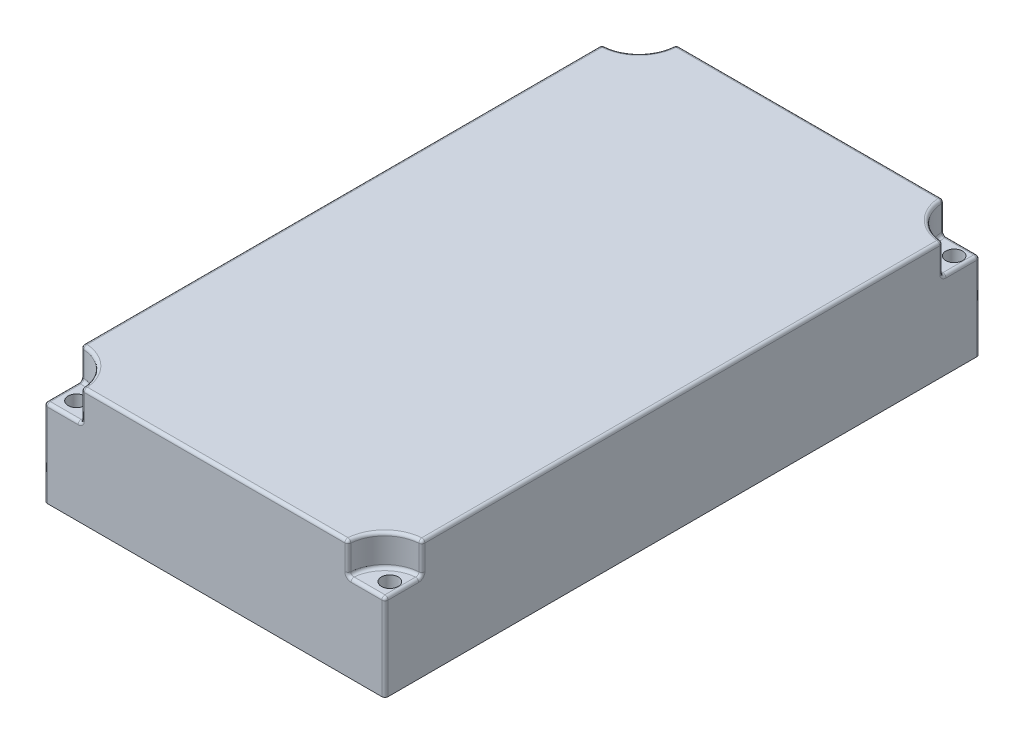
SolidWorks part; units mm, degrees
ref_plane "Plan de face" through (0, 0, 0) normal (0, 0, 1) x (1, 0, 0)
ref_plane "Plan de dessus" through (0, 0, 0) normal (0, 1, 0) x (1, 0, 0)
ref_plane "Plan de droite" through (0, 0, 0) normal (1, 0, 0) x (0, 0, -1)
sketch "Esquisse1" plane through (0, 0, 0) normal (0, 0, 1) x (1, 0, 0)
  line L1 (0, 0) -> (55, 0)
  line L2 (0, 0) -> (0, 19)
  line L3 (0, 19) -> (55, 19)
  line L4 (55, 0) -> (55, 19)
  dimension "D1" = 55
  dimension "D2" = 19
extrude "Extrusion1" add sketch "Esquisse1" along normal blind 96
sketch "Esquisse2" plane through (0, 0, 0) normal (0, -1, 0) x (1, 0, 0)
  line L0 (0, 96) -> (0, 0) construction
  line L1 (6.5, 93.5) -> (48.5, 93.5)
  line L2 (2.5, 89.5) -> (2.5, 6.5)
  line L3 (6.5, 2.5) -> (48.5, 2.5)
  line L4 (52.5, 89.5) -> (52.5, 6.5)
  line L5 (55, 96) -> (55, 0) construction
  line L6 (0, 96) -> (55, 96) construction
  line L7 (0, 0) -> (55, 0) construction
  arc A0 (2.5, 89.5) -> (6.5, 93.5) centre (2.5, 93.5) ccw
  arc A1 (48.5, 93.5) -> (52.5, 89.5) centre (52.5, 93.5) ccw
  arc A2 (6.5, 2.5) -> (2.5, 6.5) centre (2.5, 2.5) ccw
  arc A3 (52.5, 6.5) -> (48.5, 2.5) centre (52.5, 2.5) ccw
  dimension "D5" = 8
  dimension "D6" = 8
  dimension "D7" = 8
  dimension "D8" = 8
  dimension "D1" = 2.5
  dimension "D2" = 2.5
  dimension "D3" = 2.5
  dimension "D4" = 2.5
extrude "Enlèv. mat.-Extru.1" cut sketch "Esquisse2" against normal blind 17.5
fillet "Congé2" radius 0.5 24 edges at (52.5, 17.5, 48) (49.6716, 17.5, 5.3284) (27.5, 17.5, 2.5) (5.3284, 17.5, 5.3284) (2.5, 17.5, 48) (5.3284, 17.5, 90.6716) (27.5, 17.5, 93.5) (49.6716, 17.5, 90.6716) (55, 19, 48) (27.5, 19, 96) (0, 19, 48) (27.5, 19, 0) (55, 9.5, 0) (55, 9.5, 96) (0, 9.5, 96) (0, 9.5, 0) (48.5, 8.75, 93.5) (52.5, 8.75, 89.5) (2.5, 8.75, 6.5) (6.5, 8.75, 2.5) (48.5, 8.75, 2.5) (52.5, 8.75, 6.5) (6.5, 8.75, 93.5) (2.5, 8.75, 89.5)
sketch "Esquisse5" plane through (0, 19, 0) normal (0, 1, 0) x (1, 0, 0)
  circle A0 centre (0, 0) radius 6
  circle A1 centre (55.2211, 0) radius 6
  circle A2 centre (0, -96.0376) radius 6
  circle A4 centre (55, -96.0376) radius 6
  dimension "D1" = 12
  dimension "D2" = 12
  dimension "D3" = 12
  dimension "D4" = 12
extrude "Enlèv. mat.-Extru.2" cut sketch "Esquisse5" against normal blind 5
fillet "Congé3" radius 0.5 36 edges at (0.1464, 14, 95.8536) (54.8536, 14, 0.1464) (54.8536, 14, 95.8536) (0.1464, 14, 0.1464) (0, 14, 92.7688) (3.2499, 14, 96) (51.8606, 14, 0) (55, 14, 3.248) (51.7501, 14, 96) (55, 14, 92.7688) (0, 14, 3.25) (3.25, 14, 0) (0, 16.25, 90.0376) (0.8545, 18.1474, 90.0988) (4.2293, 19, 91.7816) (5.9982, 18.8123, 95.8905) (5.9999, 16.25, 96) (4.2293, 14, 91.7817) (50.901, 14, 4.1637) (55, 16.25, 5.9959) (54.8125, 18.8903, 5.9861) (50.9006, 19, 4.1633) (49.2221, 18.8123, 0.1096) (49.2211, 16.25, 0) (49.0001, 16.25, 96) (49.0667, 18.1474, 95.1455) (50.7707, 19, 91.7816) (54.9228, 18.7669, 90.0381) (55, 16.25, 90.0376) (50.7707, 14, 91.7817) (0, 16.25, 6) (4.2426, 14, 4.2426) (6, 16.25, 0) (5.9971, 18.8908, 0.1881) (4.2426, 19, 4.2426) (0.1096, 18.8123, 5.999)
hole_wizard "Dégagement M2.51" positions "Esquisse7" profile "Esquisse6" hole size "M2.5" standard "ISO"
sketch "Esquisse7" plane through (0, 14, 0) normal (0, 1, 0) x (-1, 0, 0)
  point P0 (-53.0631, 93.2839)
  point P1 (-53.0631, 2.1996)
  point P3 (-2.4965, 2.1996)
  point P5 (-2.4965, 93.2839)
sketch "Esquisse6" plane through (53.0631, 14, 93.2839) normal (1, 0, 0) x (0, 0, 1)
  line L0 (0, 0) -> (0, 14)
  line L1 (0, 14) -> (1.35, 14)
  line L2 (1.35, 14) -> (1.35, 0)
  line L5 (1.35, 0) -> (0, 0)
  line L11 (0, -6.35) -> (0, 107.95) construction
  dimension "Diamètre du perçage jusqu'au prochain" = 2.7
  dimension "Profondeur du perçage jusqu'au prochain" = 14
